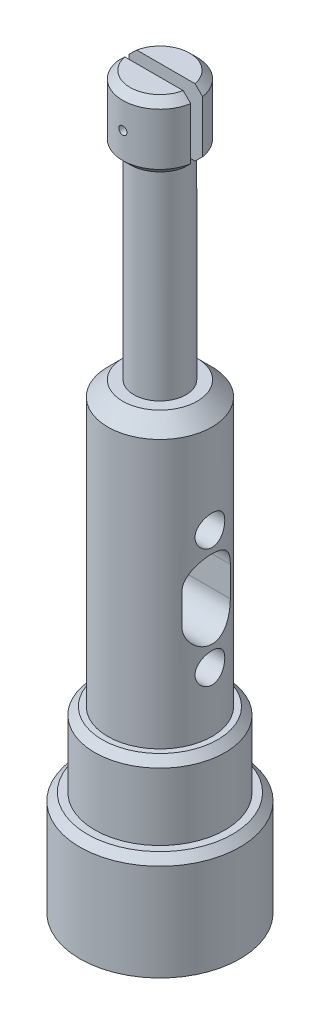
SolidWorks part; units mm, degrees
ref_plane "Front Plane" through (0, 0, 0) normal (0, 0, 1) x (1, 0, 0)
ref_plane "Top Plane" through (0, 0, 0) normal (0, 1, 0) x (1, 0, 0)
ref_plane "Right Plane" through (0, 0, 0) normal (1, 0, 0) x (0, 0, -1)
sketch "Sketch1" plane through (0, 0, 0) normal (0, 1, 0) x (1, 0, 0)
  circle A0 centre (0, 0) radius 10.75
  dimension "D1" = 21.5
extrude "Boss-Extrude1" add sketch "Sketch1" along normal blind 14
sketch "Sketch2" plane through (0, 14, 0) normal (0, 1, 0) x (1, 0, 0)
  circle A0 centre (0, 0) radius 8.75
  dimension "D1" = 17.5
extrude "Boss-Extrude2" add sketch "Sketch2" along normal blind 10
sketch "Sketch3" plane through (0, 24, 0) normal (0, 1, 0) x (1, 0, 0)
  circle A0 centre (0, 0) radius 7
  dimension "D1" = 14
extrude "Boss-Extrude3" add sketch "Sketch3" along normal blind 38
sketch "Sketch4" plane through (0, 62, 0) normal (0, 1, 0) x (1, 0, 0)
  circle A0 centre (0, 0) radius 3.5
  dimension "D1" = 7
extrude "Boss-Extrude4" add sketch "Sketch4" along normal blind 27
sketch "Sketch5" plane through (0, 89, 0) normal (0, 1, 0) x (1, 0, 0)
  circle A0 centre (0, 0) radius 5
  dimension "D1" = 10
extrude "Boss-Extrude5" add sketch "Sketch5" along normal blind 9
hole_wizard "M5x0.8 Tapped Hole1" positions "Sketch7" profile "Sketch6" tap size "M5x0.8" standard "ANSI Metric"
sketch "Sketch7" plane through (0, 0, 0) normal (0, -1, 0) x (-1, 0, 0)
  point P0 (0, 0)
sketch "Sketch6" plane through (0, 0, 0) normal (1, 0, 0) x (0, 0, -1)
  line L0 (0, 0) -> (0, 18.6618)
  line L1 (0, 18.6618) -> (2.1, 17.4)
  line L2 (2.1, 17.4) -> (2.1, 0)
  line L5 (2.1, 0) -> (0, 0)
  line L10 (0, 18.6618) -> (-2.1, 17.4) construction
  line L11 (0, -6.35) -> (0, 107.95) construction
  dimension "Tap Drill Dia." = 4.2
  dimension "Tap Drill Depth" = 17.4
  dimension "Drill Angle" = 118
sketch "Sketch8" plane through (0, 0, 0) normal (1, 0, 0) x (0, 0, -1)
  line L0 (-3.25, 38) -> (-3.25, 42)
  line L1 (3.25, 42) -> (3.25, 38)
  line L2 (0, 0) -> (0, 129.8755) construction
  line L3 (-10.75, 0) -> (10.75, 0) construction
  arc A0 (-3.25, 42) -> (3.25, 42) centre (0, 42) cw
  arc A1 (3.25, 38) -> (-3.25, 38) centre (0, 38) cw
  dimension "D3" = 38
  dimension "D1" = 6.5
  dimension "D2" = 4
extrude "Cut-Extrude1" cut sketch "Sketch8" against normal through all both and the other way through all
sketch "Sketch12" plane through (0, 0, 0) normal (0, 0, 1) x (1, 0, 0)
  line L0 (0, 0) -> (0, 50000) construction
  line L1 (-11.0987, 40.5914) -> (7, 40.5914) construction
  line L2 (7, 47.1745) -> (7, 37.1406) construction
  line L3 (7, 45.25) -> (7, 62) construction
ref_plane "Plane1" through (7, 40.5914, 0) normal (1, 0, 0) x (0, 0, -1)
hole_wizard "Ø4.0mm Press Dowel Hole1" positions "Sketch15" profile "Sketch14" hole size "Ø4.0" standard "ANSI Metric"
sketch "Sketch15" plane through (7, 40.5914, 0) normal (1, 0, 0) x (0, 0, -1)
  line L0 (0, -200040.5914) -> (0, 249959.4086) construction
  line L1 (-10.75, -40.5914) -> (10.75, -40.5914) construction
  point P0 (0, 7.4086)
  point P4 (0, -8.5914)
  dimension "D1" = 32
  dimension "D2" = 48
sketch "Sketch14" plane through (7, 48, 0) normal (0, 1, 0) x (0, 0, -1)
  line L0 (0, 0) -> (0, 11.7017)
  line L1 (0, 11.7017) -> (2, 10.5)
  line L2 (2, 10.5) -> (2, 0)
  line L5 (2, 0) -> (0, 0)
  line L10 (0, 11.7017) -> (-2, 10.5) construction
  line L11 (0, -6.35) -> (0, 107.95) construction
  dimension "Hole Dia." = 4
  dimension "Hole Depth" = 10.5
  dimension "Drill Angle" = 118
sketch "Sketch16" plane through (0, 0, 0) normal (1, 0, 0) x (0, 0, -1)
  line L0 (5, 98) -> (-5, 98) construction
  line L1 (-0.8, 98) -> (0.8, 98)
  line L2 (-0.8, 98) -> (-0.8, 89)
  line L3 (-0.8, 89) -> (0.8, 89)
  line L4 (0.8, 98) -> (0.8, 89)
  line L5 (-3.5, 89) -> (3.5, 89) construction
  line L6 (0, -200000) -> (0, 250000) construction
  dimension "D1" = 1.6
  dimension "D2" = 0.8
extrude "Cut-Extrude2" cut sketch "Sketch16" against normal through all both and the other way through all
sketch "Sketch17" plane through (0, 0, 0) normal (0, 0, 1) x (1, 0, 0)
  line L0 (0, -200000) -> (0, 250000) construction
  line L1 (4.9356, 98) -> (-4.9356, 98) construction
  circle A0 centre (0, 93.5) radius 0.55
  dimension "D1" = 1.1
  dimension "D2" = 4.5
extrude "Cut-Extrude3" cut sketch "Sketch17" against normal through all both and the other way through all
chamfer "Chamfer 1mm" distance 1 angle 45 6 edges at (0, 14, 10.75) (0, 24, 8.75) (0, 89, 5) (0, 98, 5) (0, 89, -5) (0, 98, -5)
chamfer "Chamfer2" distance 2 angle 45 1 edges at (0, 62, 7)
